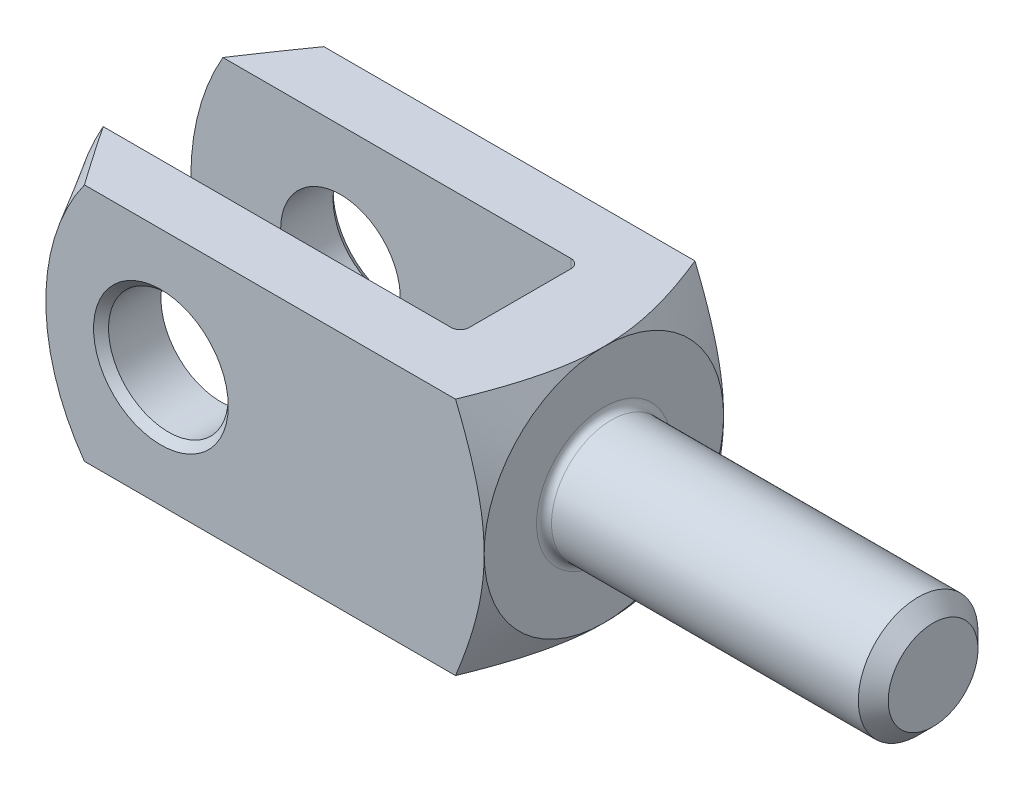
SolidWorks part; units mm, degrees
ref_plane "Front Plane" through (0, 0, 0) normal (0, 0, 1) x (1, 0, 0)
ref_plane "Top Plane" through (0, 0, 0) normal (0, 1, 0) x (1, 0, 0)
ref_plane "Right Plane" through (0, 0, 0) normal (1, 0, 0) x (0, 0, -1)
sketch "Sketch1" plane through (0, 0, 0) normal (1, 0, 0) x (0, 0, -1)
  line L0 (0, 0) -> (0, 50000) construction
  line L1 (0, 0) -> (50000, 0) construction
  line L2 (-20, -20) -> (-20, 20)
  line L3 (-20, 20) -> (20, 20)
  line L4 (20, -20) -> (20, 20)
  line L5 (-20, -20) -> (20, -20)
  point P9 (0, 20)
  point P11 (20, 0)
  point P12 (-20, 0)
  dimension "D1" = 40
  dimension "D2" = 40
extrude "Extrude1" add sketch "Sketch1" against normal blind 134
sketch "Sketch2" plane through (0, 0, 0) normal (1, 0, 0) x (0, 0, -1)
  circle A0 centre (0, 0) radius 10
  circle A1 centre (0, 0) radius 40
  dimension "D1" = 20
  dimension "D2" = 80
extrude "Extrude2" cut sketch "Sketch2" against normal blind 55
sketch "Sketch3" plane through (0, 0, 20) normal (0, 0, 1) x (1, 0, 0)
  circle A0 centre (-109, 0) radius 10
  dimension "D1" = 20
  dimension "D2" = 109
extrude "Extrude3" cut sketch "Sketch3" against normal through all
sketch "Sketch4" plane through (0, 20, 0) normal (0, 1, 0) x (1, 0, 0)
  line L0 (0, 0) -> (-50000, 0) construction
  line L1 (-134, -10) -> (-134, 10)
  line L2 (-134, 20) -> (-134, -20) construction
  line L3 (-134, 10) -> (-69, 10)
  line L4 (-69, 10) -> (-69, -10)
  line L5 (-109, 20) -> (-109, -20) construction
  line L6 (-134, -10) -> (-69, -10)
  point P7 (-109, 0)
  point P13 (-69, 0)
  point P14 (-134, 0)
  dimension "D1" = 40
  dimension "D2" = 20
extrude "Extrude4" cut sketch "Sketch4" against normal through all
fillet "Fillet1" radius 1.5 2 edges at (-69, 0, 10) (-69, 0, -10)
fillet "Fillet2" radius 1.25 1 edges at (-55, 0, -10)
chamfer "Chamfer2" distance 1.25 angle 45 2 edges at (-99, 0, -20) (-99, 0, 20)
sketch "Sketch6" plane through (0, 0, 0) normal (0, 0, 1) x (1, 0, 0)
  line L0 (-55, -20) -> (-55, -40)
  line L1 (-55, -40) -> (-66.547, -40)
  line L2 (-66.547, -40) -> (-55, -20)
  dimension "D1" = 30
  dimension "D2" = 40
revolve "Cut-Revolve1" cut sketch "Sketch6" angle 360 about axis through (-55, 0, 0) along (1, 0, 0)
sketch "Sketch7" plane through (0, 0, 0) normal (0, 1, 0) x (1, 0, 0)
  line L0 (-128.2265, -20) -> (-134, -10)
  line L1 (-134, 10) -> (-128.2265, 20)
  line L2 (-128.2265, 20) -> (-174, 20)
  line L3 (-134, 10) -> (-134, -10)
  line L4 (-174, 20) -> (-174, -20)
  line L5 (-174, -20) -> (-128.2265, -20)
  line L6 (-134, 20) -> (-59.7829, 20) construction
  line L7 (-134, -20) -> (-59.7829, -20) construction
  line L8 (-94, 0.6162) -> (-94, 50000.6162) construction
  dimension "D1" = 120
  dimension "D2" = 40
  dimension "D3" = 40
revolve "Cut-Revolve2" cut sketch "Sketch7" angle 180 about L8
chamfer "Chamfer3" distance 2.5 angle 45 1 edges at (0, 0, -10)
equation "\"D2@Sketch1\" = \"D1@Sketch1\""
equation "\"D2@Sketch2\" = \"D1@Sketch1\"/.5"
equation "\"D2@Sketch6\" = \"D1@Sketch1\""
equation "\"D2@Sketch7\" = \"D1@Sketch1\""
equation "\"D3@Sketch7\" = \"D1@Sketch1\""
